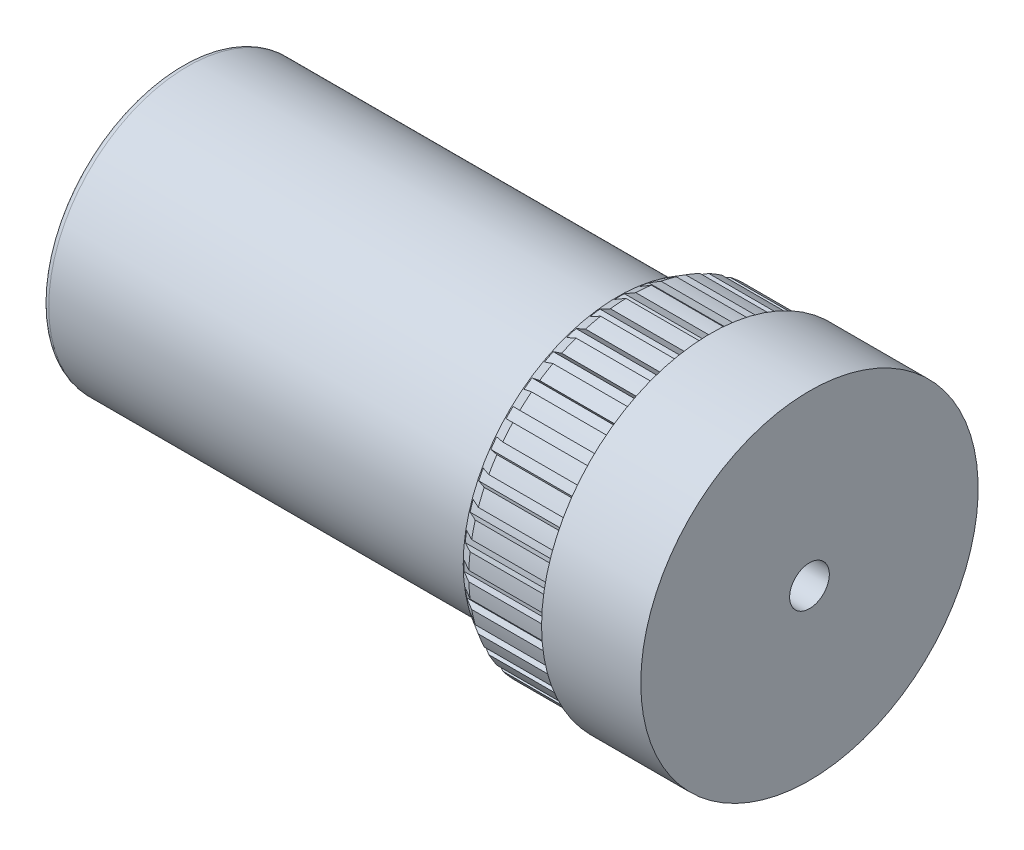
SolidWorks part; units mm, degrees
ref_plane "Plan de face" through (0, 0, 0) normal (0, 0, 1) x (1, 0, 0)
ref_plane "Plan de dessus" through (0, 0, 0) normal (0, 1, 0) x (1, 0, 0)
ref_plane "Plan de droite" through (0, 0, 0) normal (1, 0, 0) x (0, 0, -1)
sketch "Esquisse1" plane through (0, 0, 0) normal (0, 0, 1) x (1, 0, 0)
  line L0 (0, 0) -> (85.8328, 0) construction
  line L1 (0, 6) -> (0, 40)
  line L2 (2, 42) -> (132, 42)
  line L3 (132, 42) -> (132, 49)
  line L4 (132, 49) -> (160, 49)
  line L5 (160, 49) -> (160, 51)
  line L6 (160, 51) -> (190, 51)
  line L7 (190, 51) -> (190, 6)
  line L9 (0, 6) -> (190, 6)
  arc A0 (0, 40) -> (2, 42) centre (2, 40) cw
  point P13 (0, 42)
  dimension "D8" = 2
  dimension "D1" = 84
  dimension "D2" = 190
  dimension "D3" = 132
  dimension "D4" = 28
  dimension "D5" = 98
  dimension "D6" = 102
  dimension "D7" = 12
revolve "Révolution1" add sketch "Esquisse1" angle 360 about L0
chamfer "Chanfrein1" distance 4 angle 30 1 edges at (132, 0, 49)
sketch "Esquisse2" plane through (132, 0, 0) normal (-1, 0, 0) x (0, 0, 1)
  line L0 (0, 47) -> (0, 49) construction
  line L1 (-1.5, 48.977) -> (-1.5, 46.9761)
  line L2 (1.5, 48.977) -> (1.5, 46.9761)
  circle A2 centre (0, 0) radius 47
  arc A3 (1.5, 46.9761) -> (-1.5, 46.9761) centre (0, 0) ccw
  circle A4 centre (0, 0) radius 49 construction
  circle A5 centre (0, 0) radius 49 construction
  arc A6 (1.5, 48.977) -> (-1.5, 48.977) centre (0, 0) ccw
  dimension "D2" = 3
  dimension "D1" = 5
extrude "Enlèv. mat.-Extru.1" cut sketch "Esquisse2" against normal up to surface (28 mm away)
pattern_circular "Répétition circulaire1" count 40 over 360 about axis through (0, 0, 0) along (1, 0, 0) of "Enlèv. mat.-Extru.1"
